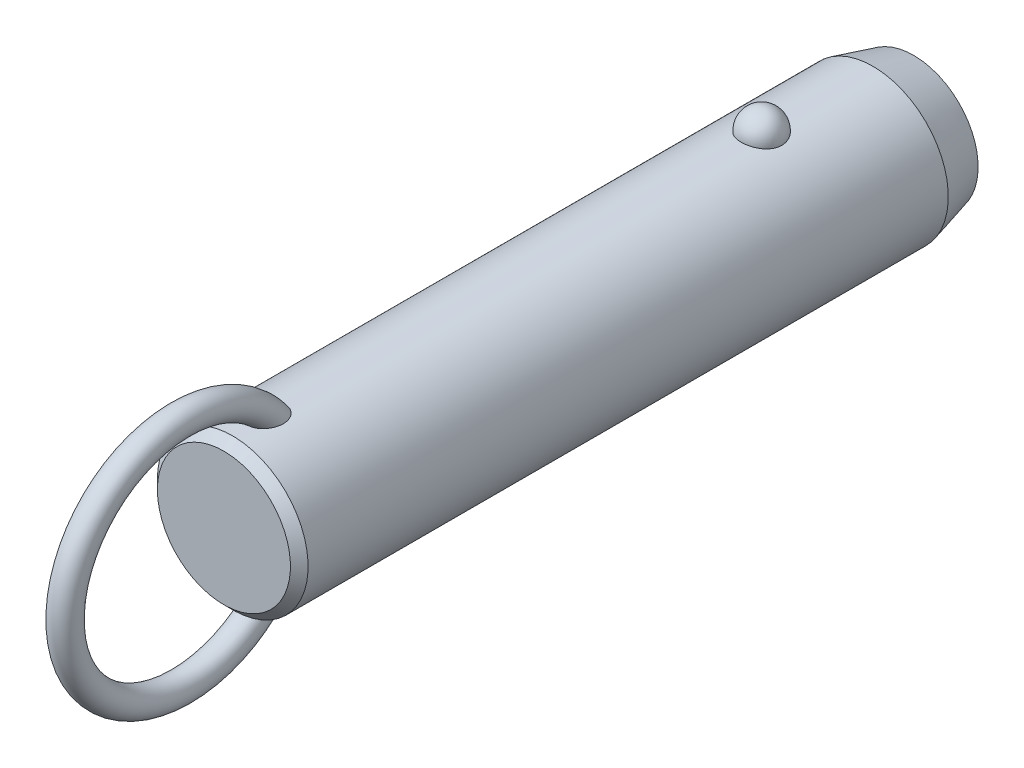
SolidWorks part; units mm, degrees
ref_plane "Front Plane" through (0, 0, 0) normal (0, 0, 1) x (1, 0, 0)
ref_plane "Top Plane" through (0, 0, 0) normal (0, 1, 0) x (1, 0, 0)
ref_plane "Right Plane" through (0, 0, 0) normal (1, 0, 0) x (0, 0, -1)
sketch "Sketch2" plane through (0, 0, 0) normal (0, 0, 1) x (1, 0, 0)
  circle A0 centre (0, 0) radius 11.1
  point P3 (0, 11.1)
  dimension "D1" = 22.2
extrude "Boss-Extrude1" add sketch "Sketch2" along normal blind 63.5
sketch "Sketch3" plane through (0, 0, 0) normal (0, 0, -1) x (-1, 0, 0)
  circle A0 centre (0, 0) radius 11.1
  dimension "D1" = 22.2
extrude "Boss-Extrude2" add sketch "Sketch3" along normal blind 25.4
chamfer "Chamfer1" distance 6 angle 15 1 edges at (-11.1, 0, -25.4)
sketch "Sketch12" plane through (0, 0, 0) normal (1, 0, 0) x (0, 0, -1)
  line L0 (-63.5, 11.1) -> (-63.5, -11.1) construction
  point P0 (-63.5, 0)
sketch "Sketch13" plane through (0, 0, 0) normal (1, 0, 0) x (0, 0, -1)
  circle A0 centre (-82.55, 0) radius 19.05
  point P2 (-63.5, 0)
  dimension "D1" = 38.1
sketch "Sketch14" plane through (0, 0, 0) normal (0, 1, 0) x (1, 0, 0)
  circle A0 centre (0, -65.5) radius 2
  point P2 (0, -63.5)
  dimension "D1" = 4
sweep "Sweep1" add profiles "Sketch14" path "Sketch13"
sketch "Sketch15" plane through (0, 0, 63.5) normal (0, 0, 1) x (1, 0, 0)
  circle A0 centre (0, 0) radius 11.1
  dimension "D1" = 22.2
extrude "Boss-Extrude3" add sketch "Sketch15" along normal blind 12.7
chamfer "Chamfer2" distance 1.3 angle 45 1 edges at (11.1, 0, 76.2)
sketch "Sketch18" plane through (0, 0, 0) normal (1, 0, 0) x (0, 0, -1)
  line L0 (19.4, 11.1) -> (-67.068, 11.1) construction
  line L1 (3, 14.1) -> (3, 8.1)
  line L2 (-67.068, -11.1) -> (19.4, -11.1) construction
  arc A0 (3, 14.1) -> (3, 8.1) centre (3, 11.1) ccw
  point P4 (0, 11.1)
  dimension "D1" = 25.2
revolve "Revolve1" add sketch "Sketch18" angle 360 about L1
